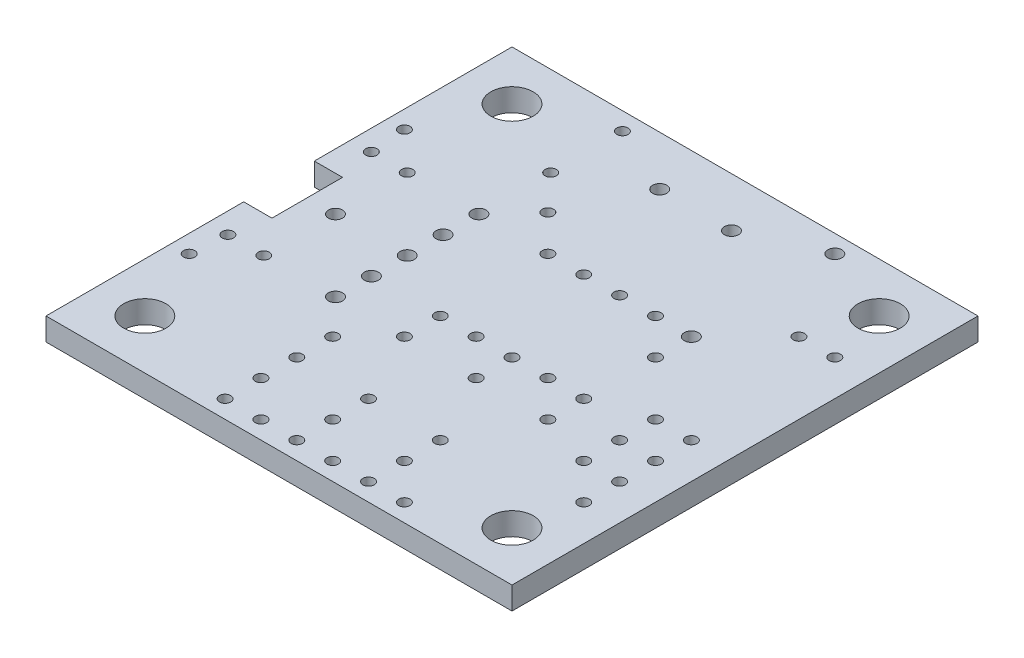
SolidWorks part; units mm, degrees
ref_plane "Plan de face" through (0, 0, 0) normal (0, 0, 1) x (1, 0, 0)
ref_plane "Plan de dessus" through (0, 0, 0) normal (0, 1, 0) x (1, 0, 0)
ref_plane "Plan de droite" through (0, 0, 0) normal (1, 0, 0) x (0, 0, -1)
sketch "Esquisse1" plane through (0, 0, 0) normal (0, 1, 0) x (1, 0, 0)
  line L0 (53.3553, 33) -> (-2.7178, 33) construction
  line L1 (0, 0) -> (33, 0)
  line L2 (0, 0) -> (0, 14)
  line L3 (0, 33) -> (33, 33)
  line L4 (33, 0) -> (33, 33)
  line L5 (53.3553, 0) -> (-2.7178, 0) construction
  line L6 (0, -2.55) -> (0, 50.0374) construction
  line L7 (33, -2.55) -> (33, 50.0374) construction
  line L8 (53.3553, 16.5) -> (-2.7178, 16.5) construction
  line L9 (3.5, -2.55) -> (3.5, 5.48) construction
  line L10 (16.5, 50.0374) -> (16.5, -2.55) construction
  line L11 (-2.7178, 3.5) -> (5.5185, 3.5) construction
  line L12 (0, 19) -> (0, 33)
  line L13 (4, 37.4553) -> (4, 13.0694) construction
  line L14 (34.446, 1.26) -> (6.1792, 1.26) construction
  line L15 (0, 19) -> (2, 19)
  line L16 (2, 19) -> (2, 14)
  line L17 (2, 14) -> (0, 14)
  line L18 (52.0853, 16.5) -> (-3.9878, 16.5) construction
  line L19 (22.3246, 29.5) -> (17.3378, 29.5) construction
  line L20 (19.04, 31.74) -> (19.04, 27.944) construction
  circle A0 centre (3.5, 3.5) radius 1.5
  circle A1 centre (29.5, 3.5) radius 1.5
  circle A2 centre (3.5, 29.5) radius 1.5
  circle A3 centre (29.5, 29.5) radius 1.5
  circle A4 centre (4, 16.5) radius 0.5
  circle A5 centre (9.08, 16.5) radius 0.5
  circle A6 centre (9.08, 13.96) radius 0.5
  circle A7 centre (9.08, 11.42) radius 0.5
  circle A8 centre (1.46, 21.58) radius 0.4
  circle A9 centre (4, 11.42) radius 0.4
  circle A10 centre (1.46, 11.42) radius 0.4
  circle A11 centre (16.5, 21.58) radius 0.4
  circle A12 centre (4, 21.58) radius 0.4
  circle A13 centre (9.08, 21.58) radius 0.5
  circle A14 centre (9.08, 19.04) radius 0.5
  circle A15 centre (9.08, 26.66) radius 0.4
  circle A16 centre (9.08, 31.74) radius 0.4
  circle A17 centre (16.5, 3.8) radius 0.4
  circle A18 centre (16.5, 6.34) radius 0.4
  circle A19 centre (24.12, 11.42) radius 0.4
  circle A20 centre (16.5, 1.26) radius 0.4
  circle A21 centre (19.04, 11.42) radius 0.4
  circle A22 centre (13.96, 11.42) radius 0.4
  circle A23 centre (13.96, 1.26) radius 0.4
  circle A24 centre (11.42, 3.8) radius 0.4
  circle A25 centre (11.42, 6.34) radius 0.4
  circle A26 centre (11.42, 1.26) radius 0.4
  circle A27 centre (1.26, 8.88) radius 0.4
  circle A28 centre (11.42, 24.12) radius 0.4
  circle A29 centre (19.04, 1.26) radius 0.4
  circle A30 centre (21.58, 3.8) radius 0.4
  circle A31 centre (21.58, 6.34) radius 0.4
  circle A32 centre (21.58, 1.26) radius 0.4
  circle A33 centre (1.26, 24.12) radius 0.4
  circle A34 centre (16.5, 13.96) radius 0.4
  circle A35 centre (24.12, 1.26) radius 0.4
  circle A36 centre (13.96, 13.96) radius 0.4
  circle A37 centre (13.96, 21.58) radius 0.4
  circle A38 centre (11.42, 8.88) radius 0.4
  circle A39 centre (19.04, 21.58) radius 0.4
  circle A40 centre (19.04, 13.96) radius 0.4
  circle A41 centre (21.58, 21.58) radius 0.4
  circle A42 centre (21.58, 13.96) radius 0.4
  circle A45 centre (24.12, 21.58) radius 0.5
  circle A46 centre (24.12, 31.74) radius 0.5
  circle A47 centre (30.47, 15.23) radius 0.4
  circle A48 centre (27.93, 15.23) radius 0.4
  circle A49 centre (19.04, 29.5) radius 0.5
  circle A50 centre (13.96, 29.5) radius 0.5
  circle A51 centre (30.47, 12.69) radius 0.4
  circle A52 centre (27.93, 12.69) radius 0.4
  circle A53 centre (30.47, 10.15) radius 0.4
  circle A54 centre (27.93, 10.15) radius 0.4
  circle A55 centre (30.47, 25.39) radius 0.4
  circle A56 centre (27.93, 25.39) radius 0.4
  circle A57 centre (24.12, 19.04) radius 0.4
  circle A58 centre (24.12, 13.96) radius 0.4
  circle A62 centre (30.47, 7.61) radius 0.4
  dimension "D5" = 4
  dimension "D6" = 3.5
  dimension "D8" = 2
  dimension "D1" = 16.5
  dimension "D2" = 16.5
  dimension "D3" = 3.5
  dimension "D4" = 3.5
  dimension "D7" = 2.54
extrude "Extrusion1" add sketch "Esquisse1" along normal blind 1.6
